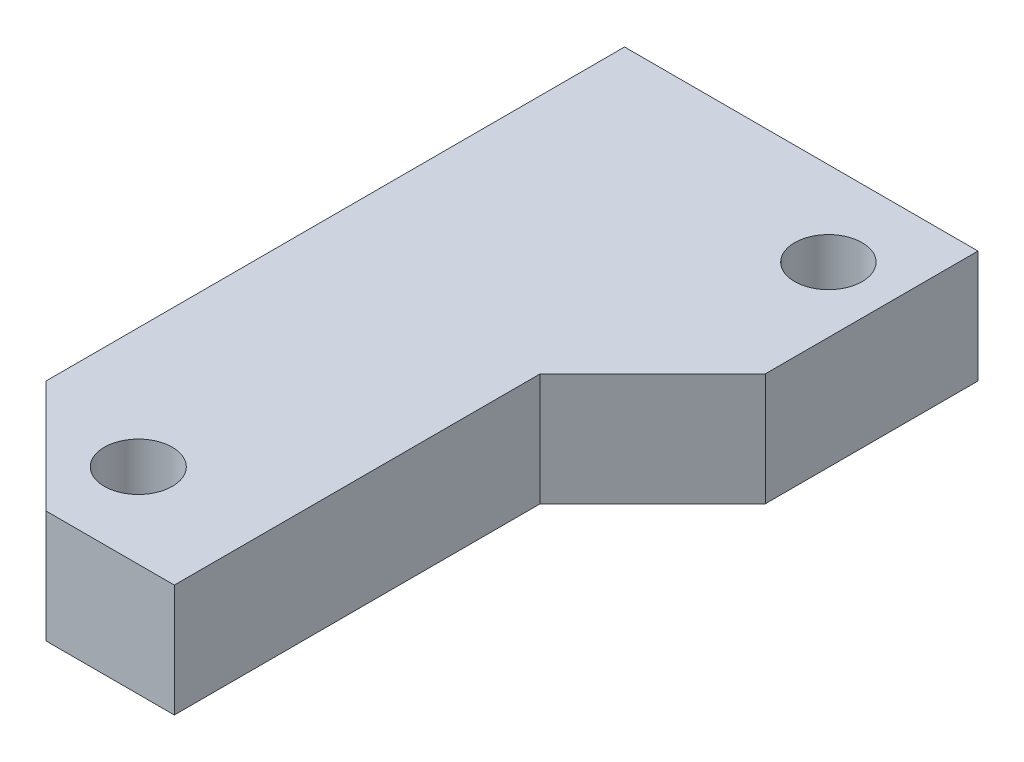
SolidWorks part; units mm, degrees
ref_plane "Front Plane" through (0, 0, 0) normal (0, 0, 1) x (1, 0, 0)
ref_plane "Top Plane" through (0, 0, 0) normal (0, 1, 0) x (1, 0, 0)
ref_plane "Right Plane" through (0, 0, 0) normal (1, 0, 0) x (0, 0, -1)
sketch "Sketch7" plane through (0, 0, 0) normal (0, 1, 0) x (-1, 0, 0)
  line L0 (-51.78, -11.28) -> (-39.22, -11.28)
  line L5 (-39.22, -11.28) -> (-39.22, 9.28)
  line L6 (-39.22, 9.28) -> (-43.22, 13.28)
  line L8 (-43.22, 13.28) -> (-47.78, 13.28)
  line L13 (-47.78, 13.28) -> (-47.78, 0.28)
  line L14 (-47.78, 0.28) -> (-51.78, -3.72)
  line L15 (-51.78, -3.72) -> (-51.78, -11.28)
  circle A2 centre (-49.4634, -8.28) radius 1.2
  circle A3 centre (-43.5, 10.28) radius 1.2077
  point P0 (-47.78, 13.28)
extrude "Boss-Extrude5" add sketch "Sketch7" against normal blind 4
